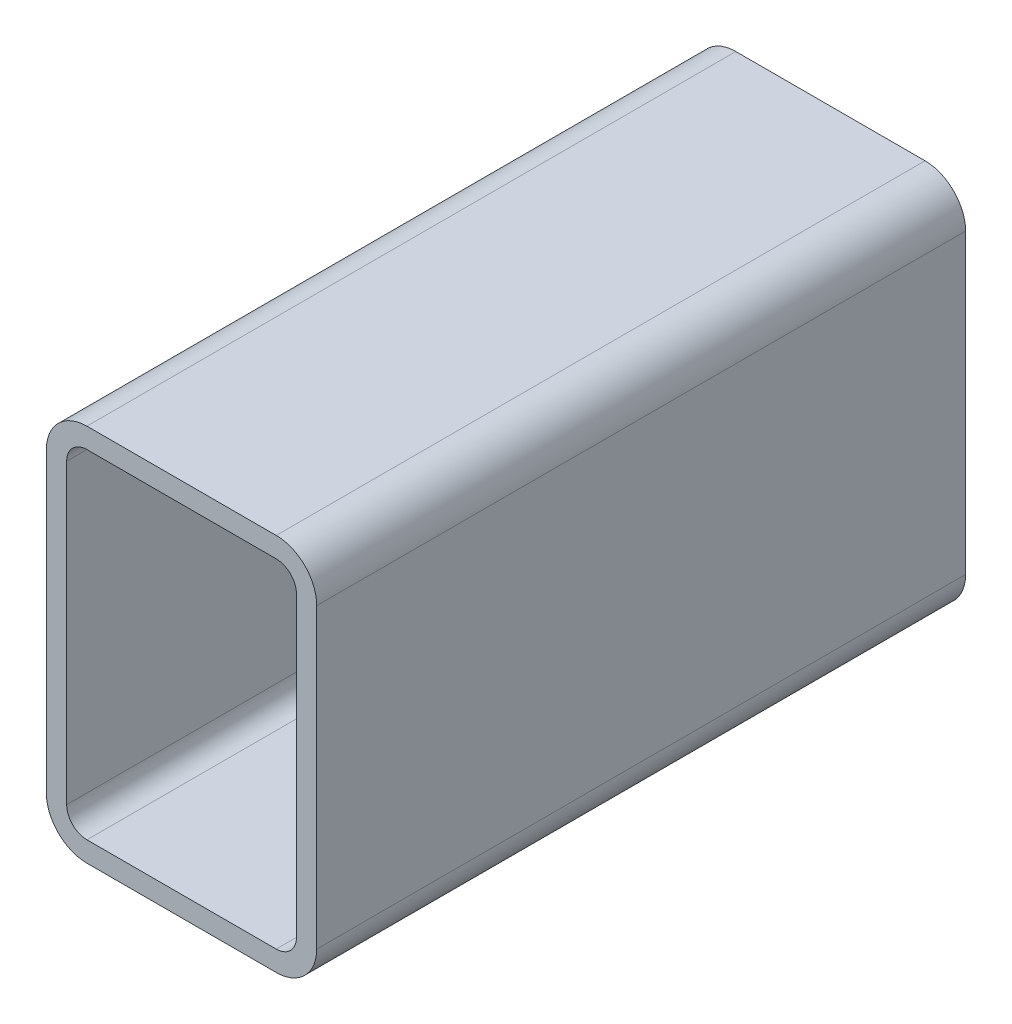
SolidWorks part; units mm, degrees
ref_plane "Front Plane" through (0, 0, 0) normal (0, 0, 1) x (1, 0, 0)
ref_plane "Top Plane" through (0, 0, 0) normal (0, 1, 0) x (1, 0, 0)
ref_plane "Right Plane" through (0, 0, 0) normal (1, 0, 0) x (0, 0, -1)
sketch "Sketch1" plane through (0, 0, 0) normal (0, 0, 1) x (1, 0, 0)
sketch_block_instance "HSS7x5x0.375-1"
sketch_block "HSS7x5x0.375"
extrude "Boss-Extrude1" add sketch "Sketch1" along normal blind 304.8
